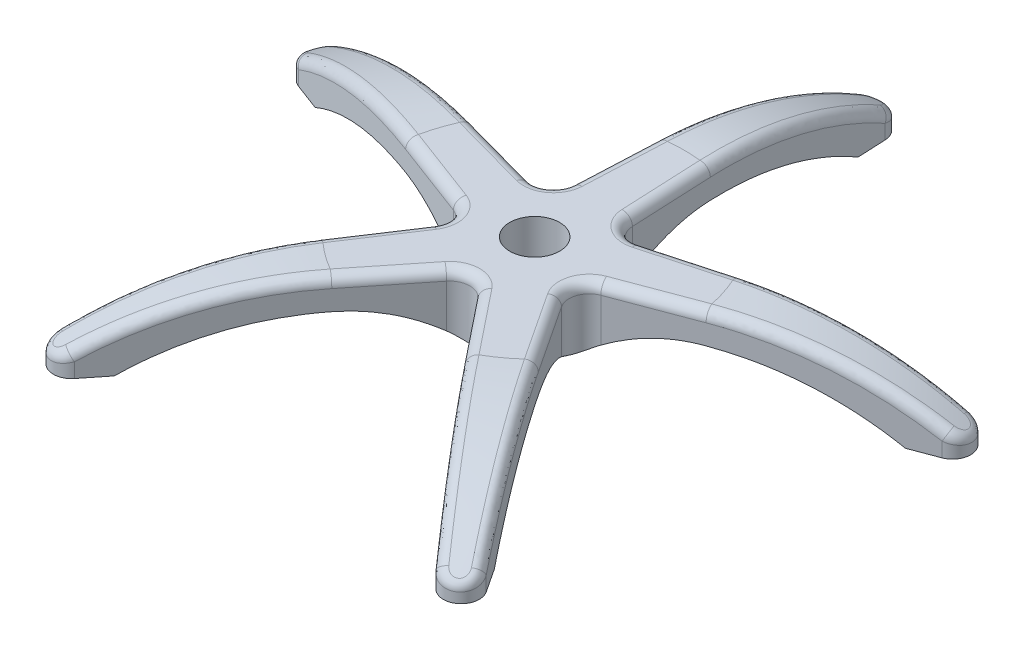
SolidWorks part; units mm, degrees
ref_plane "Plan de face" through (0, 0, 0) normal (0, 0, 1) x (1, 0, 0)
ref_plane "Plan de dessus" through (0, 0, 0) normal (0, 1, 0) x (1, 0, 0)
ref_plane "Plan de droite" through (0, 0, 0) normal (1, 0, 0) x (0, 0, -1)
sketch "Esquisse1" plane through (0, 0, 0) normal (1, 0, 0) x (0, 0, -1)
  line L0 (0, 0) -> (0, 130) construction
  line L1 (0, 55) -> (0, -55) construction
  line L2 (-65, 70) -> (-25, 70)
  line L3 (-25, 70) -> (-25, 130)
  line L4 (-25, 130) -> (-150, 130)
  line L5 (55, 0) -> (-55, 0) construction
  line L6 (-350, 66.5) -> (-340, 66.5) construction
  line L7 (-350, 56.5) -> (-305, 56.5)
  line L8 (-350, 56.5) -> (-350, 72.0561)
  line L9 (-150, 100) -> (-25, 100) construction
  arc A0 (-350, 66.5) -> (-345.2179, 75.0308) centre (-340, 66.5) cw construction
  arc A1 (-150, 130) -> (-350, 72.0561) centre (-150, -244.1332) ccw
  arc A2 (-150, 100) -> (-305, 56.5) centre (-150, -197.8994) ccw
  arc A3 (-150, 100) -> (-65, 70) centre (-150, -35.4167) cw
  dimension "D7" = 10
  dimension "D5" = 10
  dimension "D10" = 30
  dimension "D1" = 130
  dimension "D2" = 70
  dimension "D3" = 50
  dimension "D4" = 300
  dimension "D6" = 56.5
  dimension "D8" = 350
  dimension "D9" = 45
  dimension "D12" = 130
revolve "Révolution1" add sketch "Esquisse1" angle 360 about L0
sketch "Esquisse2" plane through (0, 130, 0) normal (0, 1, 0) x (1, 0, 0)
  line L0 (0, 0) -> (0, -350) construction
  line L1 (0, -55) -> (0, 55) construction
  line L2 (0, 0) -> (-205.7248, -283.1559) construction
  line L3 (-15.6319, -72.5242) -> (-181.076, -279.8218)
  line L4 (0, 0) -> (205.7248, -283.1559) construction
  line L5 (15.6319, -72.5242) -> (181.076, -279.8218)
  circle A0 centre (0, 0) radius 350 construction
  circle A1 centre (0, 0) radius 65 construction
  arc A2 (15.6319, -72.5242) -> (-15.6319, -72.5242) centre (0, -85) ccw
  arc A3 (-205.7248, -283.1559) -> (-181.076, -279.8218) centre (-195.1447, -268.5936) ccw
  arc A4 (205.7248, -283.1559) -> (181.076, -279.8218) centre (195.1447, -268.5936) cw
  arc A5 (-205.7248, -283.1559) -> (205.7248, -283.1559) centre (0, 0) ccw
  dimension "D2" = 130
  dimension "D3" = 20
  dimension "D4" = 18
  dimension "D1" = 36
extrude "Extrusion1" cut sketch "Esquisse2" against normal through all
pattern_circular "Répétition circulaire1" count 5 every 72 about axis through (0, 0, 0) along (0, 1, 0) of "Extrusion1"
fillet "Congé1" radius 10 30 edges at (-205.725, 72.0561, 283.1558) (-175.7193, 109.8572, 206.4479) (-86.1355, 130, 70.6212) (-61.8187, 130, 20.0861) (-111.1951, 130, -6.5046) (-210.717, 124.2677, -43.8993) (-332.8697, 72.0561, -108.1561) (-250.644, 109.8572, -103.3231) (-93.7821, 130, -60.0965) (-38.206, 130, -52.5861) (-28.175, 130, -107.7629) (-23.3645, 124.2677, -213.9694) (0.0002, 72.0561, -350) (20.8128, 109.8572, -270.3052) (28.175, 130, -107.7629) (38.206, 130, -52.5861) (93.7821, 130, -60.0965) (196.277, 124.2677, -88.3411) (332.8698, 72.0561, -108.1557) (263.507, 109.8572, -63.7347) (111.1951, 130, -6.5046) (61.8187, 130, 20.0861) (86.1355, 130, 70.6212) (144.6704, 124.2677, 159.3716) (205.725, 72.0561, 283.1558) (142.0434, 109.8572, 230.9149) (40.5474, 130, 103.7428) (0, 130, 65) (-40.5474, 130, 103.7428) (-106.8658, 124.2677, 186.8382)
shell "Coque1" thickness 4
sketch "Esquisse3" plane through (0, 56.5, 0) normal (0, -1, 0) x (1, 0, 0)
  circle A0 centre (-195.1447, 268.5936) radius 5.5
  circle A1 centre (-315.7508, -102.5936) radius 5.5
  circle A2 centre (0, -332) radius 5.5
  circle A3 centre (315.7508, -102.5936) radius 5.5
  circle A4 centre (195.1447, 268.5936) radius 5.5
  circle A5 centre (195.1447, 268.5936) radius 10
  circle A6 centre (-195.1447, 268.5936) radius 10
  circle A7 centre (-315.7508, -102.5936) radius 10
  circle A8 centre (0, -332) radius 10
  circle A9 centre (315.7508, -102.5936) radius 10
  dimension "D1" = 11
  dimension "D2" = 20
extrude "Boss.-Extru.1" add sketch "Esquisse3" against normal up to surface (26.0706 mm away) contours A5 A4 | A6 A0 | A7 A1 | A8 A2 | A9 A3
